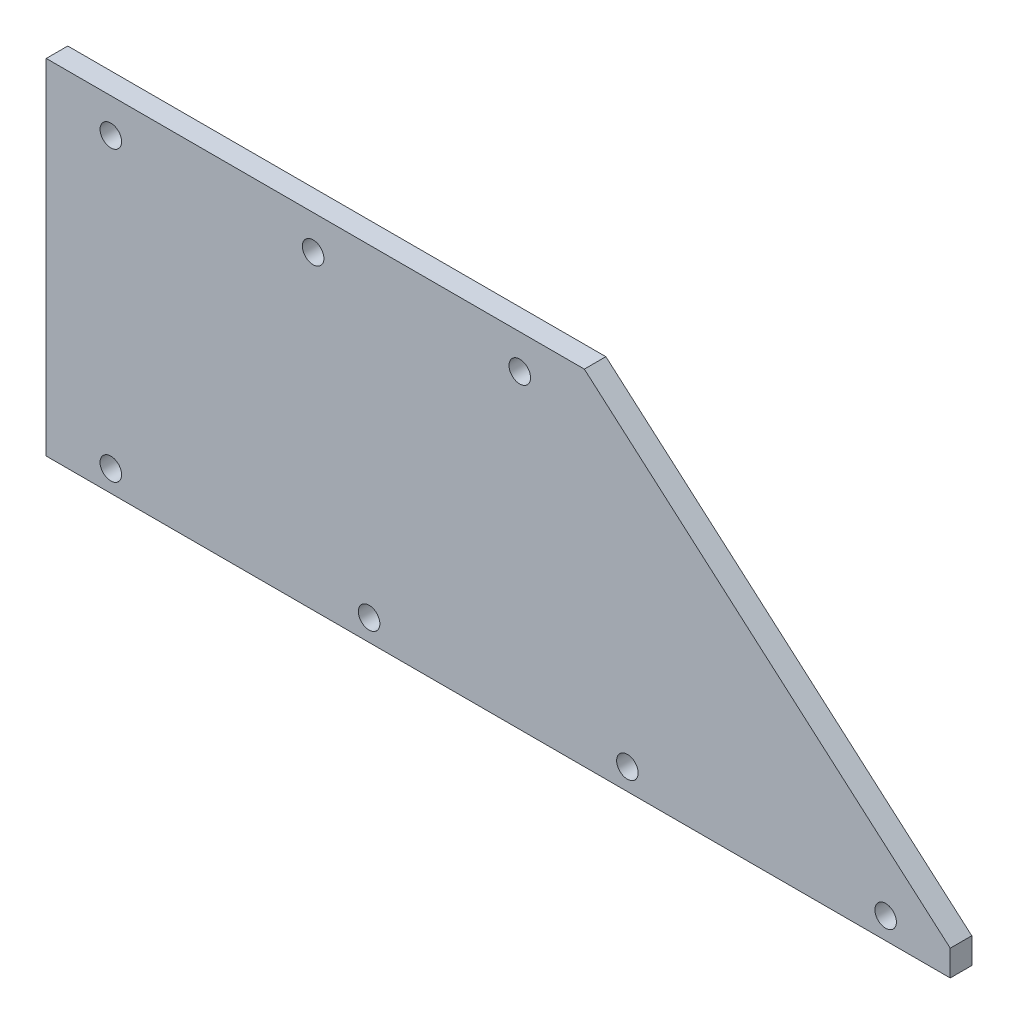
SolidWorks part; units mm, degrees
ref_plane "Front Plane" through (0, 0, 0) normal (0, 0, 1) x (1, 0, 0)
ref_plane "Top Plane" through (0, 0, 0) normal (0, 1, 0) x (1, 0, 0)
ref_plane "Right Plane" through (0, 0, 0) normal (1, 0, 0) x (0, 0, -1)
sketch "Sketch1" plane through (0, 0, 0) normal (0, 0, 1) x (1, 0, 0)
  line L0 (-1600.7247, 0) -> (78435.5111, 0) construction
  line L1 (0, -1600.7247) -> (0, 78435.5111) construction
  line L2 (0, 0) -> (266.7, 0)
  line L3 (266.7, 0) -> (266.7, 7.62)
  line L4 (266.7, 7.62) -> (158.75, 101.6)
  line L5 (158.75, 101.6) -> (0, 101.6)
  line L6 (0, 101.6) -> (0, 0)
  circle A0 centre (19.05, 6.35) radius 3.175
  circle A1 centre (19.05, 91.44) radius 3.175
  circle A2 centre (78.74, 91.44) radius 3.175
  circle A3 centre (139.7, 91.44) radius 3.175
  circle A4 centre (95.25, 6.35) radius 3.175
  circle A5 centre (171.45, 6.35) radius 3.175
  circle A6 centre (247.65, 6.35) radius 3.175
  dimension "D13" = 6.35
  dimension "D1" = 158.75
  dimension "D2" = 266.7
  dimension "D3" = 101.6
  dimension "D4" = 7.62
  dimension "D5" = 6.35
  dimension "D6" = 19.05
  dimension "D7" = 19.05
  dimension "D8" = 10.16
  dimension "D9" = 78.74
  dimension "D10" = 139.7
  dimension "D11" = 95.25
  dimension "D12" = 171.45
extrude "Boss-Extrude1" add sketch "Sketch1" along normal mid plane 6.35
